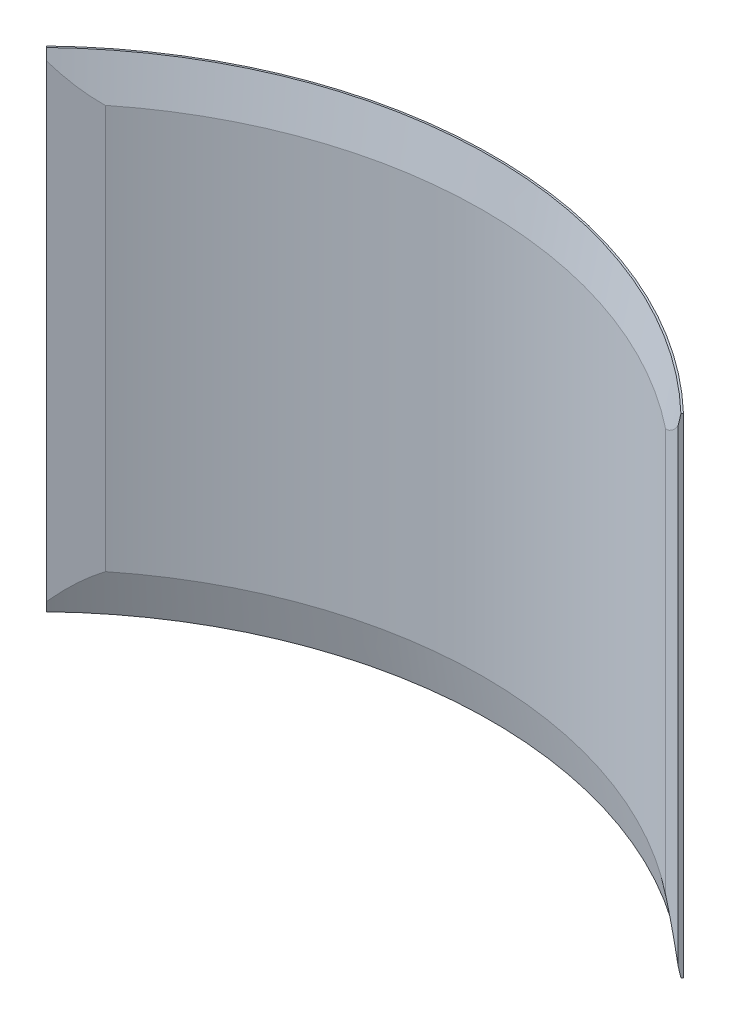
SolidWorks part; units mm, degrees
ref_plane "Front" through (0, 0, 0) normal (0, 0, 1) x (1, 0, 0)
ref_plane "Top" through (0, 0, 0) normal (0, 1, 0) x (1, 0, 0)
ref_plane "Right" through (0, 0, 0) normal (1, 0, 0) x (0, 0, -1)
sketch "Sketch1" plane through (0, 0, 0) normal (0, 1, 0) x (1, 0, 0)
  arc A0 (0, 0) -> (163.83, 0) centre (81.915, -85.0961) cw
  dimension "D1" = 163.83
  dimension "D2" = 33.02
extrude "Extrude-Thin1" add sketch "Sketch1" along normal blind 125.73 thin
chamfer "Chamfer1" distance 2.0828 distance2 10.922 4 edges at (81.915, 125.73, -30.48) (162.0685, 62.865, 1.8299) (81.915, 0, -30.48) (1.7615, 62.865, 1.8299)
